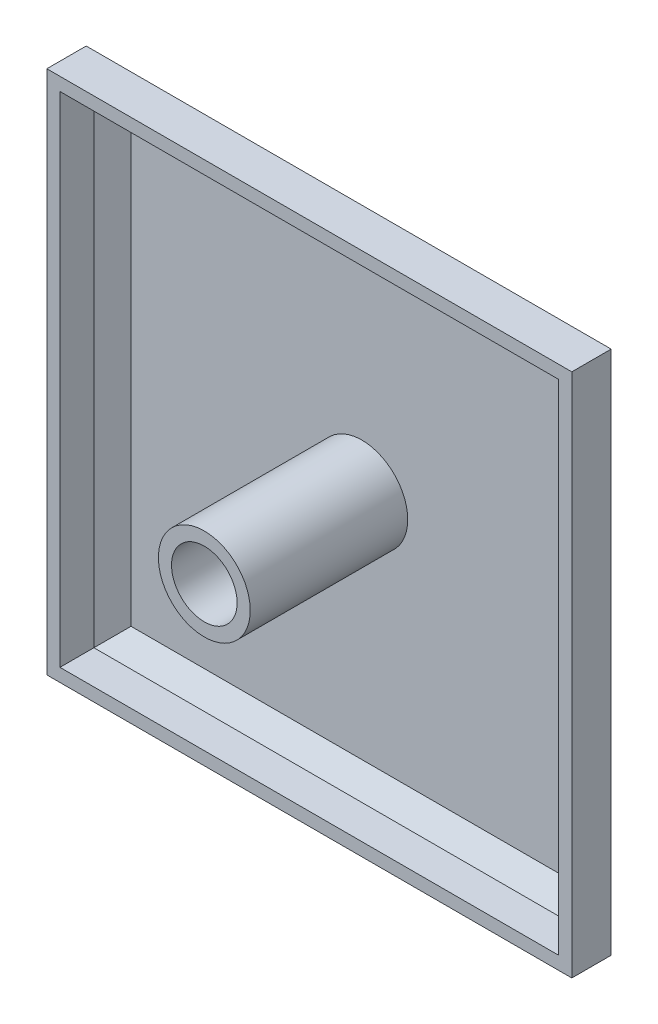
SolidWorks part; units mm, degrees
ref_plane "前视基准面" through (0, 0, 0) normal (0, 0, 1) x (1, 0, 0)
ref_plane "上视基准面" through (0, 0, 0) normal (0, 1, 0) x (1, 0, 0)
ref_plane "右视基准面" through (0, 0, 0) normal (1, 0, 0) x (0, 0, -1)
sketch "草图1" plane through (0, 0, 0) normal (0, 0, 1) x (1, 0, 0)
  line L1 (-20, 20) -> (20, 20)
  line L2 (-20, 20) -> (-20, -20)
  line L3 (-20, -20) -> (20, -20)
  line L4 (20, 20) -> (20, -20)
  dimension "D1" = 40
  dimension "D2" = 40
  dimension "D3" = 20
extrude "凸台-拉伸1" add sketch "草图1" along normal mid plane 5
chamfer "倒角1" distance 2 angle 45 4 edges at (-20, 0, -2.5) (0, -20, -2.5) (20, 0, -2.5) (0, 20, -2.5)
shell "抽壳1" thickness 1
sketch "草图2" plane through (0, 0, -1.5) normal (0, 0, 1) x (1, 0, 0)
  circle A0 centre (0, 0) radius 3.5
  circle A1 centre (0, 0) radius 2.5
extrude "凸台-拉伸2" add sketch "草图2" along normal blind 12
